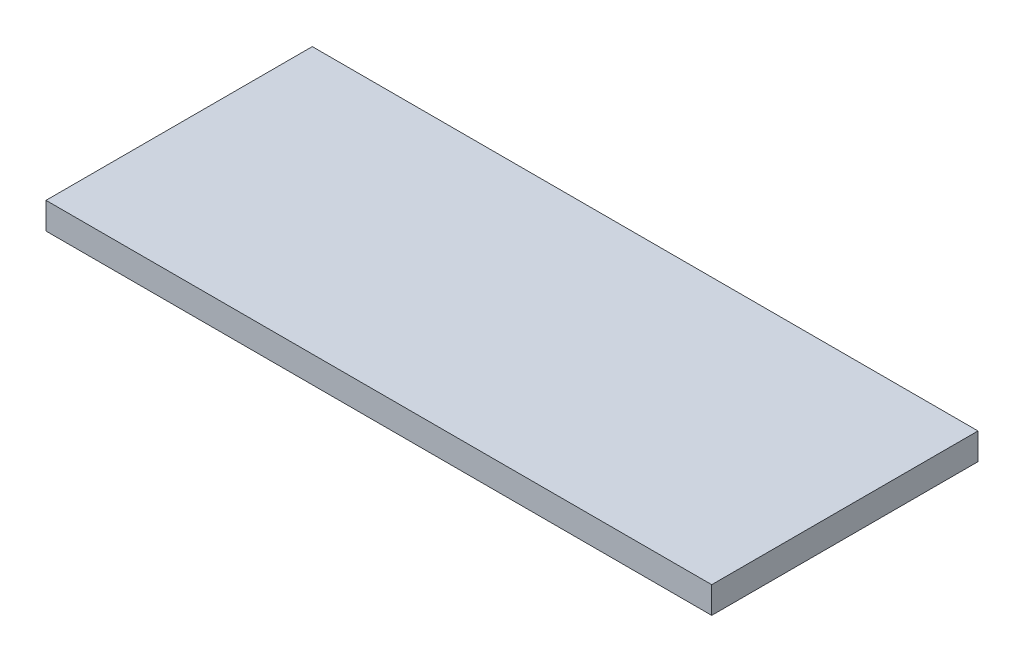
SolidWorks part; units mm, degrees
ref_plane "Ebene vorne" through (0, 0, 0) normal (0, 0, 1) x (1, 0, 0)
ref_plane "Ebene oben" through (0, 0, 0) normal (0, 1, 0) x (1, 0, 0)
ref_plane "Ebene rechts" through (0, 0, 0) normal (1, 0, 0) x (0, 0, -1)
sketch "Skizze1" plane through (0, 0, 0) normal (0, 1, 0) x (1, 0, 0)
  line L1 (-16.5133, -5.5089) -> (-14.0133, -5.5089)
  line L2 (-16.5133, -5.5089) -> (-16.5133, -6.5089)
  line L3 (-16.5133, -6.5089) -> (-14.0133, -6.5089)
  line L4 (-14.0133, -5.5089) -> (-14.0133, -6.5089)
extrude "Linear austragen1" add sketch "Skizze1" along normal blind 0.1
